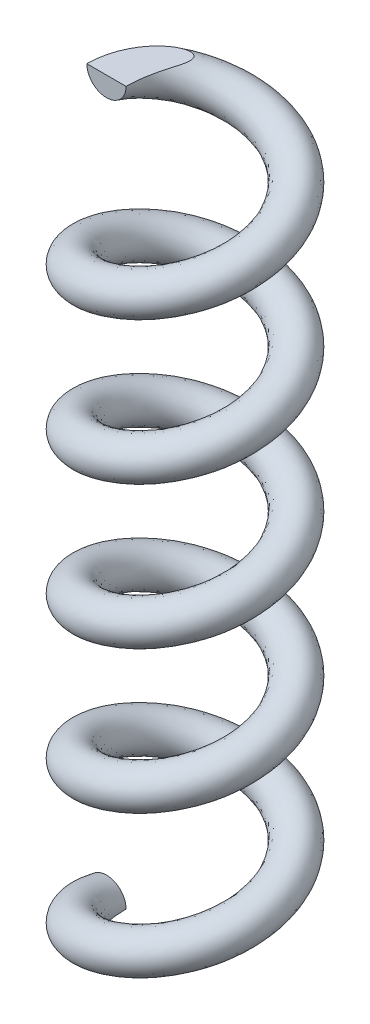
SolidWorks part; units mm, degrees
ref_plane "Front Plane" through (0, 0, 0) normal (0, 0, 1) x (1, 0, 0)
ref_plane "Top Plane" through (0, 0, 0) normal (0, 1, 0) x (1, 0, 0)
ref_plane "Right Plane" through (0, 0, 0) normal (1, 0, 0) x (0, 0, -1)
sketch "Sketch1" plane through (0, 0, 0) normal (0, 0, 1) x (1, 0, 0)
  line L1 (-24, -71.5) -> (-38, -71.5) construction
  circle A0 centre (-38, -71.5) radius 3.5
  dimension "D3" = 7
  dimension "D2" = 14
sketch "Sketch5" plane through (0, 0, 0) normal (0, 0, 1) x (1, 0, 0)
  line L0 (-24, -71.5) -> (-24, 55.49)
  line L3 (-29, 55.49) -> (-19, 55.49) construction
sweep "Sweep3" add profiles "Sketch1" path "Sketch5" parameters "D4"=1800
ref_plane "Plane3" through (0, 55.49, 0) normal (0, 1, 0) x (1, 0, 0)
ref_plane "Plane4" through (0, -71.5, 0) normal (0, 1, 0) x (1, 0, 0)
other "SurfaceCut1"
other "SurfaceCut2"
